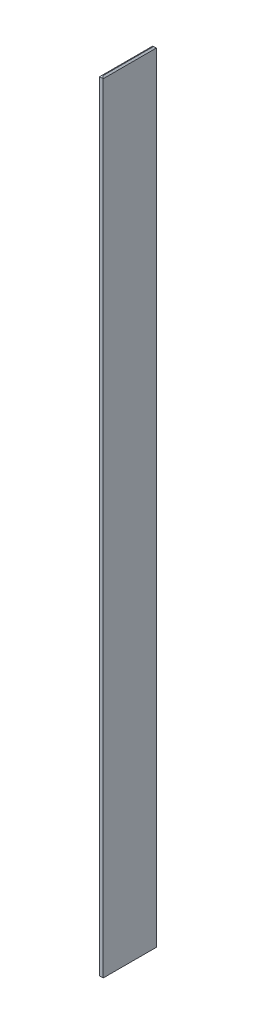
SolidWorks part; units mm, degrees
ref_plane "Front Plane" through (0, 0, 0) normal (1, 0, 0) x (0, 1, 0)
ref_plane "Top Plane" through (0, 0, 0) normal (0, 0, 1) x (0, 1, 0)
ref_plane "Right Plane" through (0, 0, 0) normal (0, 1, 0) x (-1, 0, 0)
sketch "Sketch1" plane through (0, 0, 0) normal (0, 1, 0) x (-1, 0, 0)
  line L1 (-25.4, 381) -> (25.4, 381)
  line L2 (-25.4, 381) -> (-25.4, -381)
  line L3 (-25.4, -381) -> (25.4, -381)
  line L4 (25.4, 381) -> (25.4, -381)
  line L5 (-25.4, 381) -> (25.4, -381) construction
  line L6 (-25.4, -381) -> (25.4, 381) construction
  point P0 (0, 0)
  dimension "D1" = 762
  dimension "D2" = 50.8
extrude "Boss-Extrude1" add sketch "Sketch1" along normal blind 11217.681
ref_plane "Mating plane" through (0, 0, -631) normal (0, 0, -1) x (0, 1, 0)
chamfer "Chamfer1" distance 20 angle 45 8 edges at (0, 0, 381) (25.4, 0, 0) (0, 0, -381) (-25.4, 0, 0) (0, 11217.681, -381) (25.4, 11217.681, 0) (0, 11217.681, 381) (-25.4, 11217.681, 0)
